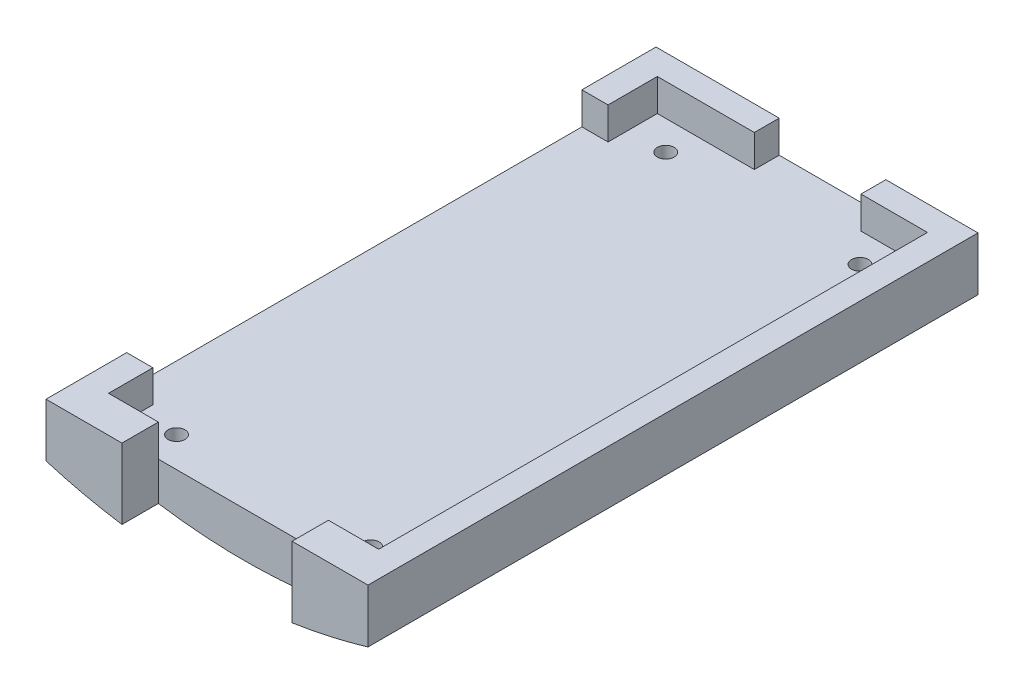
SolidWorks part; units mm, degrees
ref_plane "Front Plane" through (0, 0, 0) normal (0, 0, 1) x (1, 0, 0)
ref_plane "Top Plane" through (0, 0, 0) normal (0, 1, 0) x (1, 0, 0)
ref_plane "Right Plane" through (0, 0, 0) normal (1, 0, 0) x (0, 0, -1)
sketch "Sketch5" plane through (0, 0, 0) normal (0, 0, 1) x (1, 0, 0)
  circle A1 centre (0, 66.802) radius 66.802
  dimension "D1" = 133.604
extrude "Boss-Extrude2" add sketch "Sketch5" along normal blind 72.39
sketch "Sketch6" plane through (0, 0, 0) normal (0, 0, -1) x (-1, 0, 0)
  line L1 (66.831, 133.604) -> (-66.831, 133.604)
  line L2 (66.831, 133.604) -> (66.831, 0)
  line L3 (66.831, 0) -> (-66.831, 0)
  line L4 (-66.831, 133.604) -> (-66.831, 0)
  line L5 (66.831, 133.604) -> (-66.831, 0) construction
  line L6 (66.831, 0) -> (-66.831, 133.604) construction
  line L11 (-66.831, 0) -> (-19.0753, 0)
  line L12 (-66.831, 0) -> (-66.831, 166.5394)
  line L13 (-66.831, 166.5394) -> (-19.0753, 166.5394)
  line L14 (-19.0753, 0) -> (-19.0753, 166.5394)
  point P0 (0, 66.802)
  dimension "D1" = 133.604
sketch "Sketch7" plane through (0, 0, 0) normal (0, 0, -1) x (-1, 0, 0)
  line L1 (66.831, 0) -> (19.1333, 0)
  line L2 (66.831, 0) -> (66.831, 210.5314)
  line L3 (66.831, 210.5314) -> (19.1333, 210.5314)
  line L4 (19.1333, 0) -> (19.1333, 210.5314)
  line L5 (-66.831, 133.604) -> (66.831, 133.604)
  line L6 (-66.831, 133.604) -> (-66.831, 12.802)
  line L7 (-66.831, 12.802) -> (66.831, 12.802)
  line L8 (66.831, 133.604) -> (66.831, 12.802)
extrude "Cut-Extrude2" cut sketch "Sketch6" against normal blind 76.2 contours L12 L13 L14 L11
extrude "Cut-Extrude6" cut sketch "Sketch7" against normal blind 76.2 contours L4 L3 L2 L1
sketch "Sketch8" plane through (0, 0, 0) normal (0, 0, -1) x (-1, 0, 0)
  line L1 (-32.3115, 0) -> (32.3115, 0)
  line L2 (-32.3115, 0) -> (-32.3115, 133.604)
  line L3 (-32.3115, 133.604) -> (32.3115, 133.604)
  line L4 (32.3115, 0) -> (32.3115, 133.604)
  line L5 (-32.3115, 0) -> (32.3115, 133.604) construction
  line L6 (-32.3115, 133.604) -> (32.3115, 0) construction
  line L7 (-32.3115, 133.604) -> (51.7103, 133.604)
  line L8 (-32.3115, 133.604) -> (-32.3115, 9.144)
  line L9 (-32.3115, 9.144) -> (51.7103, 9.144)
  line L10 (51.7103, 133.604) -> (51.7103, 9.144)
  point P0 (0, 66.802)
  dimension "D1" = 133.604
  dimension "D2" = 124.46
extrude "Cut-Extrude7" cut sketch "Sketch8" against normal blind 76.2 contours L7 L10 L9 L8
sketch "Sketch16" plane through (0, 0, 72.39) normal (0, 0, 1) x (1, 0, 0)
  line L1 (10.0616, -8.8163) -> (-10.1196, -8.8163)
  line L2 (10.0616, -8.8163) -> (10.0616, 27.6879)
  line L3 (10.0616, 27.6879) -> (-10.1196, 27.6879)
  line L4 (-10.1196, -8.8163) -> (-10.1196, 27.6879)
  line L5 (10.0616, -8.8163) -> (-10.1196, 27.6879) construction
  line L6 (10.0616, 27.6879) -> (-10.1196, -8.8163) construction
  point P0 (-0.029, 9.4358)
extrude "Cut-Extrude11" cut sketch "Sketch16" against normal blind 4.318 contours L1 L4 L3 L2
sketch "Sketch17" plane through (0, 9.144, 0) normal (0, 1, 0) x (1, 0, 0)
  line L9 (16.0272, -71.1496) -> (-16.0272, -71.1496)
  line L10 (16.0272, -71.1496) -> (16.0272, -4.9829)
  line L11 (16.0272, -4.9829) -> (-16.0272, -4.9829)
  line L12 (-16.0272, -71.1496) -> (-16.0272, -4.9829)
  line L13 (16.0272, -71.1496) -> (-16.0272, -4.9829) construction
  line L14 (16.0272, -4.9829) -> (-16.0272, -71.1496) construction
  point P0 (0, -38.0662)
extrude "Cut-Extrude12" cut sketch "Sketch17" against normal blind 3.81 contours L10 L11 L12 L9
sketch "Sketch19" plane through (0, 5.334, 0) normal (0, 1, 0) x (1, 0, 0)
  line L1 (16.0272, -4.9829) -> (-15.9768, -4.9829)
  line L2 (16.0272, -4.9829) -> (16.0272, -2.9509)
  line L3 (16.0272, -2.9509) -> (-15.9768, -2.9509)
  line L4 (-15.9768, -4.9829) -> (-15.9768, -2.9509)
  dimension "D1" = 32.004
  dimension "D2" = 2.032
extrude "Cut-Extrude17" cut sketch "Sketch19" along normal through all contours L3 L4 L1 L2
sketch "Sketch25" plane through (0, 9.144, 0) normal (0, 1, 0) x (1, 0, 0)
  line L1 (8.14, -3.6578) -> (-4.5146, -3.6578)
  line L2 (8.14, -3.6578) -> (8.14, 1.4008)
  line L3 (8.14, 1.4008) -> (-4.5146, 1.4008)
  line L4 (-4.5146, -3.6578) -> (-4.5146, 1.4008)
  line L5 (8.14, -3.6578) -> (-4.5146, 1.4008) construction
  line L6 (8.14, 1.4008) -> (-4.5146, -3.6578) construction
  point P0 (1.8127, -1.1285)
extrude "Cut-Extrude16" cut sketch "Sketch25" against normal blind 3.81 contours L1 L4 L3 L2
sketch "Sketch26" plane through (0, 9.144, 0) normal (0, 1, 0) x (1, 0, 0)
  line L0 (-19.1333, 0) -> (-19.1333, -72.39) construction
  line L1 (-19.1333, -62.8147) -> (-16.0272, -62.8147)
  line L2 (-19.1333, -62.8147) -> (-19.1333, -8.7984)
  line L3 (-19.1333, -8.7984) -> (-16.0272, -8.7984)
  line L4 (-16.0272, -62.8147) -> (-16.0272, -8.7984)
  line L5 (-16.0272, -71.1496) -> (-16.0272, -4.9829) construction
extrude "Cut-Extrude21" cut sketch "Sketch26" against normal blind 3.81 contours L3 L4 L1 L2
sketch "Sketch32" plane through (0, 0, 71.1496) normal (0, 0, -1) x (-1, 0, 0)
  line L1 (-16.0272, 5.334) -> (-10.0616, 5.334)
  line L2 (-16.0272, 5.334) -> (-16.0272, 9.144)
  line L3 (-16.0272, 9.144) -> (-10.0616, 9.144)
  line L4 (-10.0616, 5.334) -> (-10.0616, 9.144)
extrude "Boss-Extrude9" add sketch "Sketch32" along normal blind 3.0776
sketch "Sketch33" plane through (0, 0, 71.1496) normal (0, 0, -1) x (-1, 0, 0)
  line L1 (16.0272, 5.334) -> (10.1196, 5.334)
  line L2 (16.0272, 5.334) -> (16.0272, 9.144)
  line L3 (16.0272, 9.144) -> (10.1196, 9.144)
  line L4 (10.1196, 5.334) -> (10.1196, 9.144)
extrude "Boss-Extrude10" add sketch "Sketch33" along normal blind 3.0776
sketch "Sketch34" plane through (-15.9768, 0, 0) normal (1, 0, 0) x (0, 0, -1)
  line L0 (-4.9829, 9.144) -> (-4.9829, 5.334) construction
  line L1 (-2.9509, 9.144) -> (-4.9829, 9.144)
  line L2 (-2.9509, 9.144) -> (-2.9509, 5.334)
  line L3 (-2.9509, 5.334) -> (-4.9829, 5.334)
  line L4 (-4.9829, 9.144) -> (-4.9829, 5.334)
  line L5 (-4.9829, 5.334) -> (-2.9509, 5.334) construction
extrude "Cut-Extrude22" cut sketch "Sketch34" against normal blind 0.0505 contours L3 L4 L1 L2
sketch "Sketch41" plane through (0, 9.144, 0) normal (0, 1, 0) x (1, 0, 0)
  line L1 (19.0753, 0) -> (11.496, 0)
  line L2 (19.0753, 0) -> (19.0753, -6.4259)
  line L3 (19.0753, -6.4259) -> (11.496, -6.4259)
  line L4 (11.496, 0) -> (11.496, -6.4259)
  circle A0 centre (11.496, -6.4259) radius 1.143
  dimension "D3" = 2.286
  dimension "D1" = 7.5793
  dimension "D2" = 6.4259
extrude "Boss-Extrude14" add sketch "Sketch41" against normal blind 10.16 contours A0
sketch "Sketch42" plane through (0, 9.144, 0) normal (0, 1, 0) x (1, 0, 0)
  line L1 (-19.1333, 0) -> (-11.554, 0)
  line L2 (-19.1333, 0) -> (-19.1333, -6.4259)
  line L3 (-19.1333, -6.4259) -> (-11.554, -6.4259)
  line L4 (-11.554, 0) -> (-11.554, -6.4259)
  circle A0 centre (-11.554, -6.4259) radius 1.143
  dimension "D3" = 2.286
  dimension "D1" = 6.4259
  dimension "D2" = 7.5793
extrude "Boss-Extrude16" add sketch "Sketch42" against normal blind 10.16 contours A0
sketch "Sketch43" plane through (0, 9.144, 0) normal (0, 1, 0) x (1, 0, 0)
  line L1 (19.0753, -72.39) -> (11.496, -72.39)
  line L2 (19.0753, -72.39) -> (19.0753, -64.4759)
  line L3 (19.0753, -64.4759) -> (11.496, -64.4759)
  line L4 (11.496, -72.39) -> (11.496, -64.4759)
  circle A0 centre (11.496, -64.4759) radius 1.143
  dimension "D3" = 2.286
  dimension "D1" = 7.9141
  dimension "D2" = 7.5793
extrude "Boss-Extrude17" add sketch "Sketch43" against normal blind 10.16 contours A0
sketch "Sketch44" plane through (0, 9.144, 0) normal (0, 1, 0) x (1, 0, 0)
  line L1 (-19.1333, -72.39) -> (-11.554, -72.39)
  line L2 (-19.1333, -72.39) -> (-19.1333, -64.4759)
  line L3 (-19.1333, -64.4759) -> (-11.554, -64.4759)
  line L4 (-11.554, -72.39) -> (-11.554, -64.4759)
  circle A0 centre (-11.554, -64.4759) radius 1.143
  dimension "D3" = 2.286
  dimension "D1" = 7.5793
  dimension "D2" = 7.9141
extrude "Boss-Extrude18" add sketch "Sketch44" against normal blind 10.16 contours A0
sketch "Sketch46" plane through (0, -1.016, 0) normal (0, -1, 0) x (-1, 0, 0)
  line L1 (-11.496, -62.2242) -> (-13.446, -63.35)
  line L2 (-13.446, -63.35) -> (-13.446, -65.6017)
  line L3 (-13.446, -65.6017) -> (-11.496, -66.7275)
  line L4 (-11.496, -66.7275) -> (-9.546, -65.6017)
  line L5 (-9.546, -65.6017) -> (-9.546, -63.35)
  line L6 (-9.546, -63.35) -> (-11.496, -62.2242)
  circle A0 centre (-11.496, -64.4759) radius 1.95 construction
extrude "Cut-Extrude23" cut sketch "Sketch46" against normal blind 4
sketch "Sketch47" plane through (0, 9.144, 0) normal (0, 1, 0) x (1, 0, 0)
  circle A0 centre (11.496, -64.4759) radius 1
extrude "Cut-Extrude24" cut sketch "Sketch47" against normal through all
sketch "Sketch48" plane through (0, -1.016, 0) normal (0, -1, 0) x (1, 0, 0)
  line L1 (-11.554, 62.2242) -> (-9.604, 63.35)
  line L2 (-9.604, 63.35) -> (-9.604, 65.6017)
  line L3 (-9.604, 65.6017) -> (-11.554, 66.7275)
  line L4 (-11.554, 66.7275) -> (-13.504, 65.6017)
  line L5 (-13.504, 65.6017) -> (-13.504, 63.35)
  line L6 (-13.504, 63.35) -> (-11.554, 62.2242)
  circle A0 centre (-11.554, 64.4759) radius 1.95 construction
extrude "Cut-Extrude25" cut sketch "Sketch48" against normal blind 4
sketch "Sketch49" plane through (0, 9.144, 0) normal (0, 1, 0) x (1, 0, 0)
  circle A0 centre (-11.554, -64.4759) radius 1
extrude "Cut-Extrude26" cut sketch "Sketch49" against normal through all
sketch "Sketch50" plane through (0, -1.016, 0) normal (0, -1, 0) x (1, 0, 0)
  line L1 (-11.554, 4.1742) -> (-9.604, 5.3)
  line L2 (-9.604, 5.3) -> (-9.604, 7.5517)
  line L3 (-9.604, 7.5517) -> (-11.554, 8.6775)
  line L4 (-11.554, 8.6775) -> (-13.504, 7.5517)
  line L5 (-13.504, 7.5517) -> (-13.504, 5.3)
  line L6 (-13.504, 5.3) -> (-11.554, 4.1742)
  circle A0 centre (-11.554, 6.4259) radius 1.95 construction
extrude "Cut-Extrude27" cut sketch "Sketch50" against normal blind 4
sketch "Sketch52" plane through (0, -1.016, 0) normal (0, -1, 0) x (1, 0, 0)
  line L1 (11.496, 4.1742) -> (13.446, 5.3)
  line L2 (13.446, 5.3) -> (13.446, 7.5517)
  line L3 (13.446, 7.5517) -> (11.496, 8.6775)
  line L4 (11.496, 8.6775) -> (9.546, 7.5517)
  line L5 (9.546, 7.5517) -> (9.546, 5.3)
  line L6 (9.546, 5.3) -> (11.496, 4.1742)
  circle A0 centre (11.496, 6.4259) radius 1.95 construction
extrude "Cut-Extrude28" cut sketch "Sketch52" against normal blind 4
sketch "Sketch53" plane through (0, 9.144, 0) normal (0, 1, 0) x (1, 0, 0)
  circle A0 centre (11.496, -6.4259) radius 1
extrude "Cut-Extrude29" cut sketch "Sketch53" against normal through all
sketch "Sketch54" plane through (0, 9.144, 0) normal (0, 1, 0) x (1, 0, 0)
  circle A0 centre (-11.554, -6.4259) radius 1
extrude "Cut-Extrude30" cut sketch "Sketch54" against normal through all
sketch "Sketch55" plane through (0, 9.144, 0) normal (0, 1, 0) x (1, 0, 0)
  line L1 (-16.0272, -2.9509) -> (16.0272, -2.9509)
  line L2 (-16.0272, -2.9509) -> (-16.0272, -68.072)
  line L3 (-16.0272, -68.072) -> (16.0272, -68.072)
  line L4 (16.0272, -2.9509) -> (16.0272, -68.072)
extrude "Cut-Extrude31" cut sketch "Sketch55" against normal blind 3.81 contours L2 L3 L4 L1
